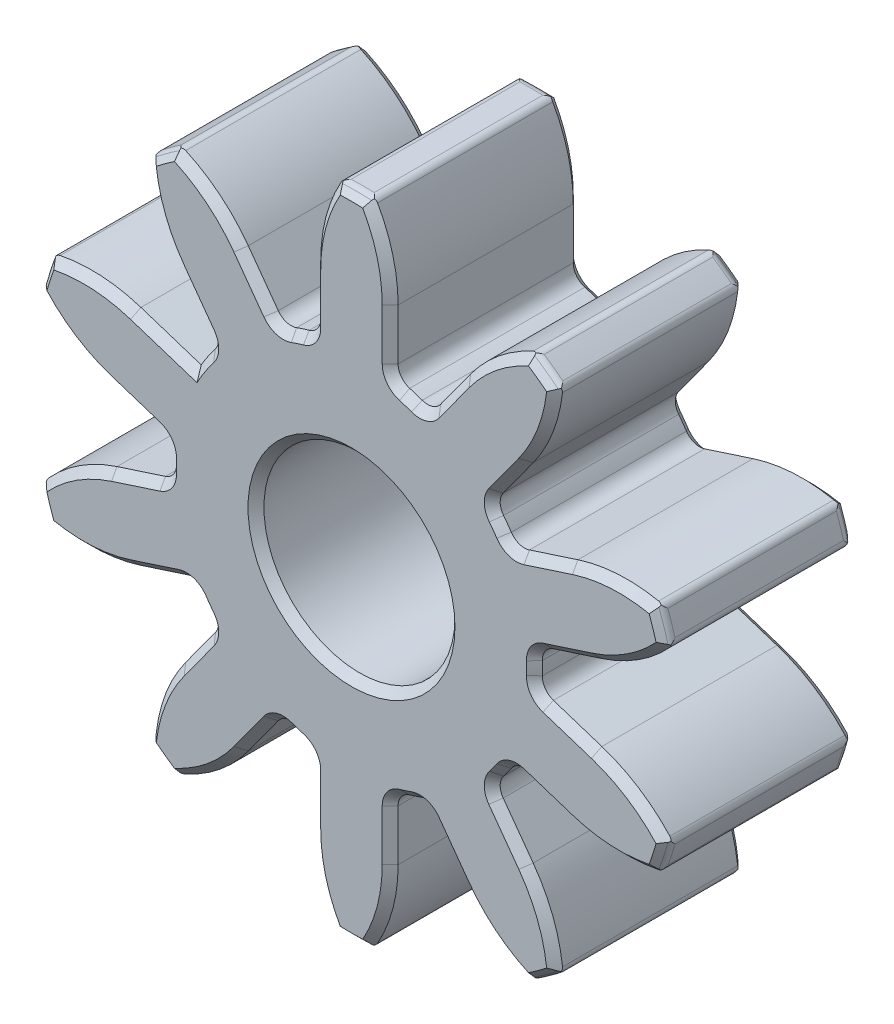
SolidWorks part; units mm, degrees
ref_plane "Спереди" through (0, 0, 0) normal (0, 0, 1) x (1, 0, 0)
ref_plane "Сверху" through (0, 0, 0) normal (0, 1, 0) x (1, 0, 0)
ref_plane "Справа" through (0, 0, 0) normal (1, 0, 0) x (0, 0, -1)
sketch "Эскиз1" plane through (0, 0, 0) normal (0, 0, 1) x (1, 0, 0)
  line L0 (1.2152, 7.6109) -> (1.2152, 6.01)
  line L1 (0, 0) -> (0, 10.2) construction
  line L2 (-1.2152, 7.6109) -> (-1.2152, 6.01)
  line L3 (5.4567, 5.443) -> (4.5157, 4.148)
  line L4 (3.4904, 6.8716) -> (2.5495, 5.5765)
  line L5 (7.6139, 1.1962) -> (6.0914, 0.7015)
  line L6 (6.8628, 3.5076) -> (5.3404, 3.0129)
  line L7 (6.8628, -3.5076) -> (5.3404, -3.0129)
  line L8 (7.6139, -1.1962) -> (6.0914, -0.7015)
  line L9 (3.4904, -6.8716) -> (2.5495, -5.5765)
  line L10 (5.4567, -5.443) -> (4.5157, -4.148)
  line L11 (-1.2152, -7.6109) -> (-1.2152, -6.01)
  line L12 (1.2152, -7.6109) -> (1.2152, -6.01)
  line L13 (-5.4567, -5.443) -> (-4.5157, -4.148)
  line L14 (-3.4904, -6.8716) -> (-2.5495, -5.5765)
  line L15 (-7.6139, -1.1962) -> (-6.0914, -0.7015)
  line L16 (-6.8628, -3.5076) -> (-5.3404, -3.0129)
  line L17 (-6.8628, 3.5076) -> (-4.9695, 2.8924)
  line L18 (-7.6139, 1.1962) -> (-6.0914, 0.7015)
  line L19 (-3.4904, 6.8716) -> (-2.5495, 5.5765)
  line L20 (-5.4567, 5.443) -> (-4.5157, 4.148)
  circle A0 centre (0, 0) radius 3
  arc A1 (-4.5266, 3.5457) -> (-4.9695, 2.8924) centre (0, 0) ccw
  circle A2 centre (0, 0) radius 8.5 construction
  arc A3 (0.5, 10.1877) -> (-0.5, 10.1877) centre (0, 0) ccw
  arc A4 (0.5, 10.1877) -> (1.2152, 7.6109) centre (-3.7848, 7.6109) cw
  arc A5 (-0.5, 10.1877) -> (-1.2152, 7.6109) centre (3.7848, 7.6109) ccw
  arc A6 (5.5837, 8.5359) -> (3.4904, 6.8716) centre (7.5355, 3.9327) ccw
  arc A7 (6.3927, 7.9482) -> (5.5837, 8.5359) centre (0, 0) ccw
  arc A8 (6.3927, 7.9482) -> (5.4567, 5.443) centre (1.4116, 8.382) cw
  arc A9 (9.5346, 3.6237) -> (6.8628, 3.5076) centre (8.4079, -1.2477) ccw
  arc A10 (9.8436, 2.6727) -> (9.5346, 3.6237) centre (0, 0) ccw
  arc A11 (9.8436, 2.6727) -> (7.6139, 1.1962) centre (6.0688, 5.9515) cw
  arc A12 (9.8436, -2.6727) -> (7.6139, -1.1962) centre (6.0688, -5.9515) ccw
  arc A13 (9.5346, -3.6237) -> (9.8436, -2.6727) centre (0, 0) ccw
  arc A14 (9.5346, -3.6237) -> (6.8628, -3.5076) centre (8.4079, 1.2477) cw
  arc A15 (6.3927, -7.9482) -> (5.4567, -5.443) centre (1.4116, -8.382) ccw
  arc A16 (5.5837, -8.5359) -> (6.3927, -7.9482) centre (0, 0) ccw
  arc A17 (5.5837, -8.5359) -> (3.4904, -6.8716) centre (7.5355, -3.9327) cw
  arc A18 (0.5, -10.1877) -> (1.2152, -7.6109) centre (-3.7848, -7.6109) ccw
  arc A19 (-0.5, -10.1877) -> (0.5, -10.1877) centre (0, 0) ccw
  arc A20 (-0.5, -10.1877) -> (-1.2152, -7.6109) centre (3.7848, -7.6109) cw
  arc A21 (-5.5837, -8.5359) -> (-3.4904, -6.8716) centre (-7.5355, -3.9327) ccw
  arc A22 (-6.3927, -7.9482) -> (-5.5837, -8.5359) centre (0, 0) ccw
  arc A23 (-6.3927, -7.9482) -> (-5.4567, -5.443) centre (-1.4116, -8.382) cw
  arc A24 (-9.5346, -3.6237) -> (-6.8628, -3.5076) centre (-8.4079, 1.2477) ccw
  arc A25 (-9.8436, -2.6727) -> (-9.5346, -3.6237) centre (0, 0) ccw
  arc A26 (-9.8436, -2.6727) -> (-7.6139, -1.1962) centre (-6.0688, -5.9515) cw
  arc A27 (-9.8436, 2.6727) -> (-7.6139, 1.1962) centre (-6.0688, 5.9515) ccw
  arc A28 (-9.5346, 3.6237) -> (-9.8436, 2.6727) centre (0, 0) ccw
  arc A29 (-9.5346, 3.6237) -> (-6.8628, 3.5076) centre (-8.4079, -1.2477) cw
  arc A30 (-6.3927, 7.9482) -> (-5.4567, 5.443) centre (-1.4116, 8.382) ccw
  arc A31 (-5.5837, 8.5359) -> (-6.3927, 7.9482) centre (0, 0) ccw
  arc A32 (-5.5837, 8.5359) -> (-3.4904, 6.8716) centre (-7.5355, 3.9327) cw
  arc A33 (-1.578, 5.5292) -> (-1.9734, 5.4008) centre (0, 0) ccw
  arc A34 (1.9734, 5.4008) -> (1.578, 5.5292) centre (0, 0) ccw
  arc A35 (4.771, 3.2094) -> (4.5266, 3.5457) centre (0, 0) ccw
  arc A36 (5.7462, -0.2079) -> (5.7462, 0.2079) centre (0, 0) ccw
  arc A37 (-4.771, -3.2094) -> (-4.5266, -3.5457) centre (0, 0) ccw
  arc A38 (-1.9734, -5.4008) -> (-1.578, -5.5292) centre (0, 0) ccw
  arc A39 (-5.7462, 0.2079) -> (-5.7462, -0.2079) centre (0, 0) ccw
  arc A40 (1.578, -5.5292) -> (1.9734, -5.4008) centre (0, 0) ccw
  arc A41 (4.5266, -3.5457) -> (4.771, -3.2094) centre (0, 0) ccw
  arc A42 (2.5495, -5.5765) -> (1.9734, -5.4008) centre (2.145, -5.8704) ccw
  arc A43 (1.2152, -6.01) -> (1.578, -5.5292) centre (1.7152, -6.01) cw
  arc A44 (-1.2152, -6.01) -> (-1.578, -5.5292) centre (-1.7152, -6.01) ccw
  arc A45 (-2.5495, -5.5765) -> (-1.9734, -5.4008) centre (-2.145, -5.8704) cw
  arc A46 (-4.5157, -4.148) -> (-4.5266, -3.5457) centre (-4.9202, -3.8541) ccw
  arc A47 (-5.3404, -3.0129) -> (-4.771, -3.2094) centre (-5.1859, -3.4884) cw
  arc A48 (-6.0914, -0.7015) -> (-5.7462, -0.2079) centre (-6.2459, -0.226) ccw
  arc A49 (-6.0914, 0.7015) -> (-5.7462, 0.2079) centre (-6.2459, 0.226) cw
  arc A50 (4.5157, -4.148) -> (4.5266, -3.5457) centre (4.9202, -3.8541) cw
  arc A51 (5.3404, -3.0129) -> (4.771, -3.2094) centre (5.1859, -3.4884) ccw
  arc A52 (6.0914, -0.7015) -> (5.7462, -0.2079) centre (6.2459, -0.226) cw
  arc A53 (6.0914, 0.7015) -> (5.7462, 0.2079) centre (6.2459, 0.226) ccw
  arc A54 (5.3404, 3.0129) -> (4.771, 3.2094) centre (5.1859, 3.4884) cw
  arc A55 (4.5157, 4.148) -> (4.5266, 3.5457) centre (4.9202, 3.8541) ccw
  arc A56 (2.5495, 5.5765) -> (1.9734, 5.4008) centre (2.145, 5.8704) cw
  arc A57 (1.2152, 6.01) -> (1.578, 5.5292) centre (1.7152, 6.01) ccw
  arc A58 (-1.2152, 6.01) -> (-1.578, 5.5292) centre (-1.7152, 6.01) cw
  arc A59 (-2.5495, 5.5765) -> (-1.9734, 5.4008) centre (-2.145, 5.8704) ccw
  arc A60 (-4.5157, 4.148) -> (-4.5266, 3.5457) centre (-4.9202, 3.8541) cw
  point P126 (1.2152, 5.6201)
  point P129 (-1.2152, 5.6201)
  dimension "D1" = 6
  dimension "D2" = 11.5
  dimension "D3" = 17
  dimension "D4" = 20.4
  dimension "D5" = 5
  dimension "D8" = 0.5
  dimension "D6" = 1
  dimension "D7" = 10
extrude "Бобышка-Вытянуть1" add sketch "Эскиз1" along normal blind 6
chamfer "Фаска1" distance 0.25 angle 45 160 edges at (3, 0, 0) (3.02, -6.224, 0) (4.4237, -7.8463, 0) (5.9954, -8.252, 0) (6.0953, -6.6319, 0) (4.9862, -4.7955, 0) (4.4203, -3.845, 0) (4.6518, -3.3798, 0) (5.0228, -3.0158, 0) (6.1016, -3.2603, 0) (8.1908, -3.7476, 0) (9.7008, -3.152, 0) (8.8293, -1.7826, 0) (6.8526, -0.9488, 0) (5.8362, -0.5125, 0) (5.75, 0, 0) (5.8362, 0.5125, 0) (6.8526, 0.9488, 0) (8.8293, 1.7826, 0) (9.7008, 3.152, 0) (8.1908, 3.7476, 0) (6.1016, 3.2603, 0) (5.0228, 3.0158, 0) (4.6518, 3.3798, 0) (4.4203, 3.845, 0) (4.9862, 4.7955, 0) (6.0953, 6.6319, 0) (5.9954, 8.252, 0) (4.4237, 7.8463, 0) (3.02, 6.224, 0) (2.2909, 5.3921, 0) (1.7768, 5.4686, 0) (1.3161, 5.7089, 0) (1.2152, 6.8105, 0) (1.0331, 8.948, 0) (0, 10.2, 0) (-1.0331, 8.948, 0) (-1.2152, 6.8105, 0) (-1.3161, 5.7089, 0) (-1.7768, 5.4686, 0) (-2.2909, 5.3921, 0) (-3.02, 6.224, 0) (-4.4237, 7.8463, 0) (-5.9954, 8.252, 0) (-6.0953, 6.6319, 0) (-4.9862, 4.7955, 0) (-4.4203, 3.845, 0) (-4.7593, 3.2267, 0) (-5.9162, 3.2, 0) (-8.1908, 3.7476, 0) (-9.7008, 3.152, 0) (-8.8293, 1.7826, 0) (-6.8526, 0.9488, 0) (-5.8362, 0.5125, 0) (-5.75, 0, 0) (-5.8362, -0.5125, 0) (-6.8526, -0.9488, 0) (-8.8293, -1.7826, 0) (-9.7008, -3.152, 0) (-8.1908, -3.7476, 0) (-6.1016, -3.2603, 0) (-5.0228, -3.0158, 0) (-4.6518, -3.3798, 0) (-4.4203, -3.845, 0) (-4.9862, -4.7955, 0) (-6.0953, -6.6319, 0) (-5.9954, -8.252, 0) (-4.4237, -7.8463, 0) (-3.02, -6.224, 0) (-2.2909, -5.3921, 0) (-1.7768, -5.4686, 0) (-1.3161, -5.7089, 0) (-1.2152, -6.8105, 0) (-1.0331, -8.948, 0) (0, -10.2, 0) (1.0331, -8.948, 0) (1.2152, -6.8105, 0) (1.3161, -5.7089, 0) (1.7768, -5.4686, 0) (2.2909, -5.3921, 0) (3, 0, 6) (1.7768, -5.4686, 6) (1.3161, -5.7089, 6) (1.2152, -6.8105, 6) (1.0331, -8.948, 6) (0, -10.2, 6) (-1.0331, -8.948, 6) (-1.2152, -6.8105, 6) (-1.3161, -5.7089, 6) (-1.7768, -5.4686, 6) (-2.2909, -5.3921, 6) (-3.02, -6.224, 6) (-4.4237, -7.8463, 6) (-5.9954, -8.252, 6) (-6.0953, -6.6319, 6) (-4.9862, -4.7955, 6) (-4.4203, -3.845, 6) (-4.6518, -3.3798, 6) (-5.0228, -3.0158, 6) (-6.1016, -3.2603, 6) (-8.1908, -3.7476, 6) (-9.7008, -3.152, 6) (-8.8293, -1.7826, 6) (-6.8526, -0.9488, 6) (-5.8362, -0.5125, 6) (-5.75, 0, 6) (-5.8362, 0.5125, 6) (-6.8526, 0.9488, 6) (-8.8293, 1.7826, 6) (-9.7008, 3.152, 6) (-8.1908, 3.7476, 6) (-5.9162, 3.2, 6) (-4.7593, 3.2267, 6) (-4.4203, 3.845, 6) (-4.9862, 4.7955, 6) (-6.0953, 6.6319, 6) (-5.9954, 8.252, 6) (-4.4237, 7.8463, 6) (-3.02, 6.224, 6) (-2.2909, 5.3921, 6) (-1.7768, 5.4686, 6) (-1.3161, 5.7089, 6) (-1.2152, 6.8105, 6) (-1.0331, 8.948, 6) (0, 10.2, 6) (1.0331, 8.948, 6) (1.2152, 6.8105, 6) (1.3161, 5.7089, 6) (1.7768, 5.4686, 6) (2.2909, 5.3921, 6) (3.02, 6.224, 6) (4.4237, 7.8463, 6) (5.9954, 8.252, 6) (6.0953, 6.6319, 6) (4.9862, 4.7955, 6) (4.4203, 3.845, 6) (4.6518, 3.3798, 6) (5.0228, 3.0158, 6) (6.1016, 3.2603, 6) (8.1908, 3.7476, 6) (9.7008, 3.152, 6) (8.8293, 1.7826, 6) (6.8526, 0.9488, 6) (5.8362, 0.5125, 6) (5.75, 0, 6) (5.8362, -0.5125, 6) (6.8526, -0.9488, 6) (8.8293, -1.7826, 6) (9.7008, -3.152, 6) (8.1908, -3.7476, 6) (6.1016, -3.2603, 6) (5.0228, -3.0158, 6) (4.6518, -3.3798, 6) (4.4203, -3.845, 6) (4.9862, -4.7955, 6) (6.0953, -6.6319, 6) (5.9954, -8.252, 6) (4.4237, -7.8463, 6) (3.02, -6.224, 6) (2.2909, -5.3921, 6)
fillet "Скругление1" radius 0.25 40 edges at (5.9954, -8.252, 5.75) (6.3927, -7.9482, 3) (5.9954, -8.252, 0.25) (5.5837, -8.5359, 3) (0, -10.2, 5.75) (0.5, -10.1877, 3) (0, -10.2, 0.25) (-0.5, -10.1877, 3) (-5.9954, -8.252, 5.75) (-5.5837, -8.5359, 3) (-5.9954, -8.252, 0.25) (-6.3927, -7.9482, 3) (-9.7008, -3.152, 5.75) (-9.5346, -3.6237, 3) (-9.7008, -3.152, 0.25) (-9.8436, -2.6727, 3) (-5.9954, 8.252, 5.75) (-6.3927, 7.9482, 3) (-5.9954, 8.252, 0.25) (-5.5837, 8.5359, 3) (-9.7008, 3.152, 5.75) (-9.8436, 2.6727, 3) (-9.7008, 3.152, 0.25) (-9.5346, 3.6237, 3) (9.7008, -3.152, 5.75) (9.8436, -2.6727, 3) (9.7008, -3.152, 0.25) (9.5346, -3.6237, 3) (9.7008, 3.152, 5.75) (9.5346, 3.6237, 3) (9.7008, 3.152, 0.25) (9.8436, 2.6727, 3) (5.9954, 8.252, 5.75) (5.5837, 8.5359, 3) (5.9954, 8.252, 0.25) (6.3927, 7.9482, 3) (0, 10.2, 5.75) (-0.5, 10.1877, 3) (0, 10.2, 0.25) (0.5, 10.1877, 3)
